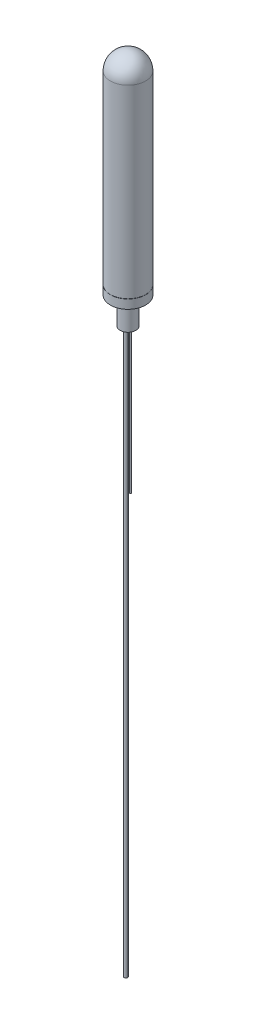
SolidWorks part; units mm, degrees
ref_plane "Front" through (0, 0, 0) normal (0, 0, 1) x (1, 0, 0)
ref_plane "Top" through (0, 0, 0) normal (0, 1, 0) x (1, 0, 0)
ref_plane "Right" through (0, 0, 0) normal (1, 0, 0) x (0, 0, -1)
sketch "Sketch1" plane through (0, 0, 0) normal (0, 0, 1) x (1, 0, 0)
  line L0 (0, 0) -> (0, 169.499) construction
  line L1 (-3.0162, -19) -> (-5.5562, -19)
  line L2 (-5.5562, -19) -> (-5.5562, 0)
  line L3 (-5.5562, 0) -> (-12.5, 0)
  line L4 (-12.5, 0) -> (-12.5, 6.35)
  line L5 (-12.5, 6.35) -> (-12.246, 6.35)
  line L6 (-12.246, 6.35) -> (-12.246, 6.477)
  line L7 (-12.246, 6.477) -> (-12.5, 6.477)
  line L8 (-12.5, 6.477) -> (-12.5, 137.5)
  line L9 (-3.0162, -19) -> (-3.0162, 0)
  line L10 (-3.0162, 0) -> (0, 0)
  line L11 (0, 0) -> (0, 150)
  line L12 (0, 150) -> (-27.9459, 150) construction
  line L13 (0, 0) -> (0, -22.9839) construction
  arc A0 (-12.5, 137.5) -> (0, 150) centre (0, 137.5) cw
  dimension "D1" = 25
  dimension "D2" = 150
  dimension "D3" = 2.54
  dimension "D4" = 11.1125
  dimension "D5" = 19
  dimension "D6" = 0.127
  dimension "D7" = 0.254
  dimension "D8" = 6.35
revolve "Revolve1" add sketch "Sketch1" angle 360 about L0
sketch "Sketch2" plane through (0, -19, 0) normal (0, -1, 0) x (1, 0, 0)
  circle A0 centre (-1.524, 0) radius 1.2446
  dimension "D1" = 2.4892
  dimension "D3" = 1.524
extrude "Boss-Extrude1" add sketch "Sketch2" along normal blind 400 separate body
sketch "Sketch3" plane through (0, -19, 0) normal (0, -1, 0) x (1, 0, 0)
  circle A0 centre (1.778, 0) radius 0.5969
  dimension "D1" = 1.1938
  dimension "D2" = 1.778
extrude "Boss-Extrude2" add sketch "Sketch3" along normal blind 101.6 separate body
